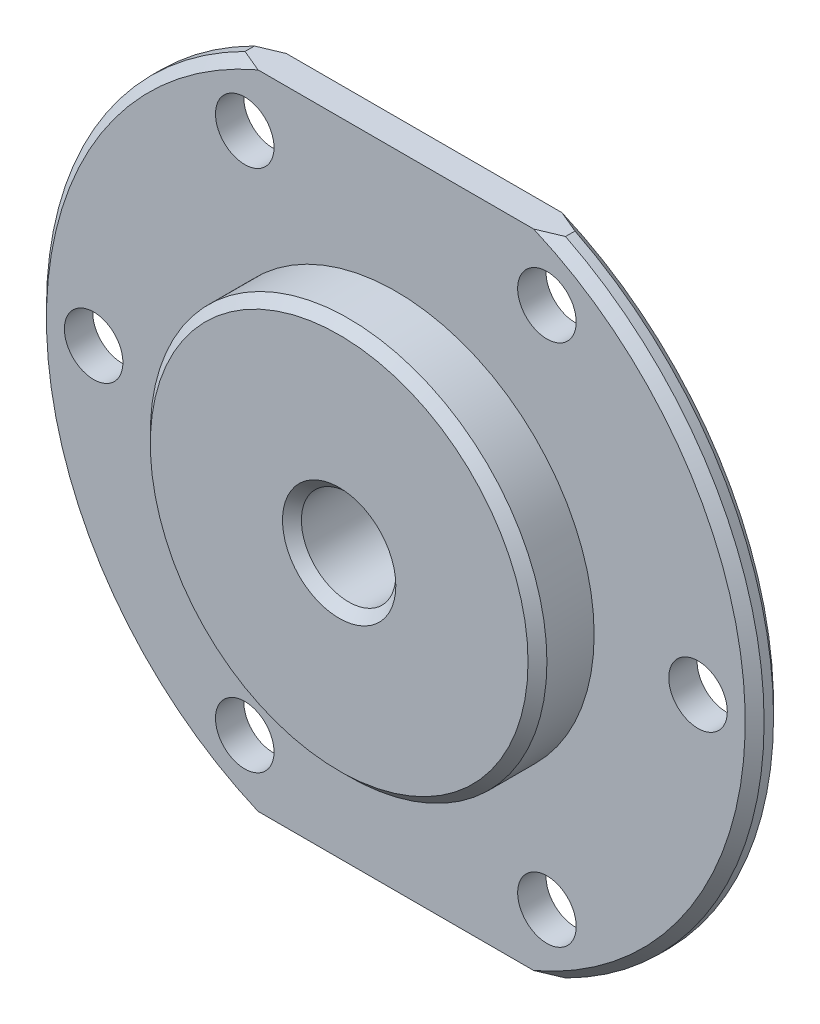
SolidWorks part; units mm, degrees
ref_plane "Front Plane" through (0, 0, 0) normal (0, 0, 1) x (1, 0, 0)
ref_plane "Top Plane" through (0, 0, 0) normal (0, 1, 0) x (1, 0, 0)
ref_plane "Right Plane" through (0, 0, 0) normal (1, 0, 0) x (0, 0, -1)
sketch "Sketch1" plane through (0, 0, 0) normal (0, 0, 1) x (1, 0, 0)
  line L0 (0, 0) -> (0, -13388.832) construction
  line L1 (0, 0) -> (13388.832, 0) construction
  line L2 (-8.485, 17) -> (8.485, 17)
  line L3 (-8.485, -17) -> (8.485, -17)
  arc A0 (-8.485, 17) -> (-8.485, -17) centre (0, 0) ccw
  arc A1 (8.485, -17) -> (8.485, 17) centre (0, 0) ccw
  point P11 (0, 0)
  point P12 (0, 0)
  point P13 (0, 0)
  dimension "D1" = 16.97
  dimension "D2" = 16.97
  dimension "D3" = 34
extrude "Boss-Extrude1" add sketch "Sketch1" along normal blind 1.5
sketch "Sketch3" plane through (0, 0, 1.5) normal (0, 0, 1) x (1, 0, 0)
  circle A0 centre (0, 0) radius 10.5
  dimension "D1" = 21
extrude "Boss-Extrude2" add sketch "Sketch3" along normal blind 3
sketch "Sketch4" plane through (0, 0, 4.5) normal (0, 0, 1) x (1, 0, 0)
  circle A0 centre (0, 0) radius 2.5
  dimension "D1" = 5
extrude "Cut-Extrude1" cut sketch "Sketch4" against normal blind 10
sketch "Sketch5" plane through (0, 0, 0) normal (0, 0, -1) x (-1, 0, 0)
  circle A0 centre (0, 0) radius 5
  dimension "D1" = 10
extrude "Boss-Extrude3" add sketch "Sketch5" along normal blind 5 contours A0 M1
sketch "Sketch6" plane through (0, 0, 1.5) normal (0, 0, 1) x (1, 0, 0)
  line L0 (0, 0) -> (0, -50000) construction
  line L1 (0, 0) -> (50000, 0) construction
  circle A0 centre (0, 0) radius 16 construction
  circle A1 centre (-16, 0) radius 1.55
  circle A2 centre (-8, 13.8564) radius 1.55
  circle A3 centre (8, 13.8564) radius 1.55
  circle A4 centre (16, 0) radius 1.55
  circle A5 centre (8, -13.8564) radius 1.55
  circle A6 centre (-8, -13.8564) radius 1.55
  point P22 (0, 0)
  dimension "D1" = 32
  dimension "D2" = 3.1
  dimension "D3" = 6
extrude "Cut-Extrude2" cut sketch "Sketch6" against normal blind 5
chamfer "Chamfer1" distance 0.5 angle 45 6 edges at (18.9999, 0, 0) (-18.9999, 0, 0) (18.9999, 0, 1.5) (-18.9999, 0, 1.5) (10.5, 0, 4.5) (2.5, 0, 4.5)
chamfer "Chamfer2" distance 0.5 angle 45 2 edges at (-2.5, 0, -5) (-5, 0, -5)
